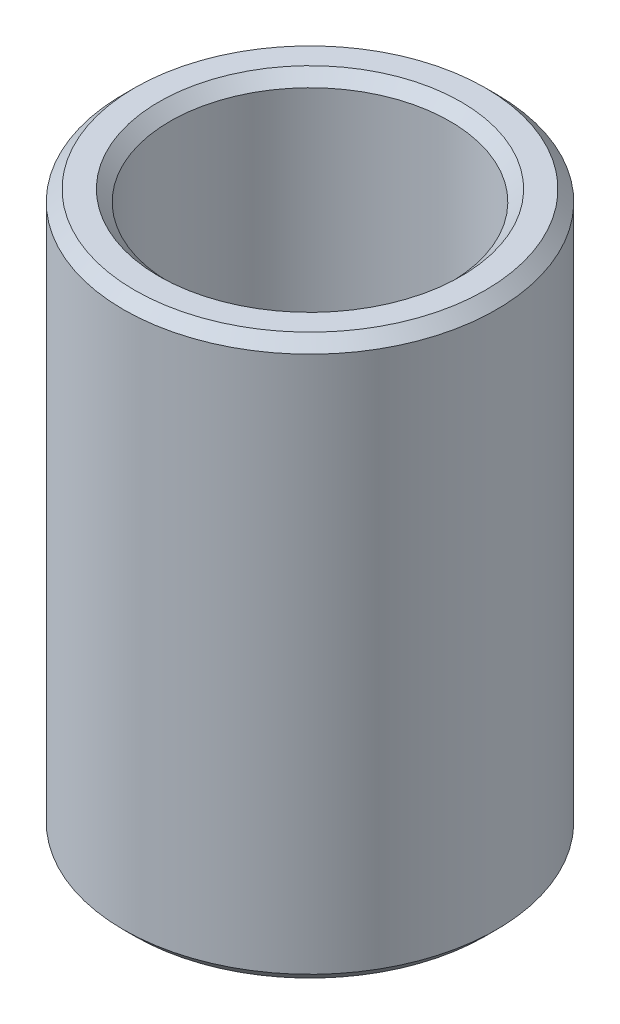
SolidWorks part; units mm, degrees
ref_plane "Front Plane" through (0, 0, 0) normal (0, 0, 1) x (1, 0, 0)
ref_plane "Top Plane" through (0, 0, 0) normal (0, 1, 0) x (1, 0, 0)
ref_plane "Right Plane" through (0, 0, 0) normal (1, 0, 0) x (0, 0, -1)
sketch "ODia" plane through (0, 0, 0) normal (0, 1, 0) x (1, 0, 0)
  circle A0 centre (0, 0) radius 25.4063
  dimension "D1" = 50.8127
extrude "Length" add sketch "ODia" along normal blind 76.2
sketch "IDia" plane through (0, 76.2, 0) normal (0, -1, 0) x (1, 0, 0)
  circle A0 centre (0, 0) radius 19.0563
  dimension "D1" = 38.1127
extrude "Extrude1" cut sketch "IDia" along normal through all
chamfer "Chamfer1" distance 1.524 angle 45 4 edges at (0, 0, -19.0563) (0, 76.2, -19.0563) (0, 76.2, 25.4063) (0, 0, 25.4063)
